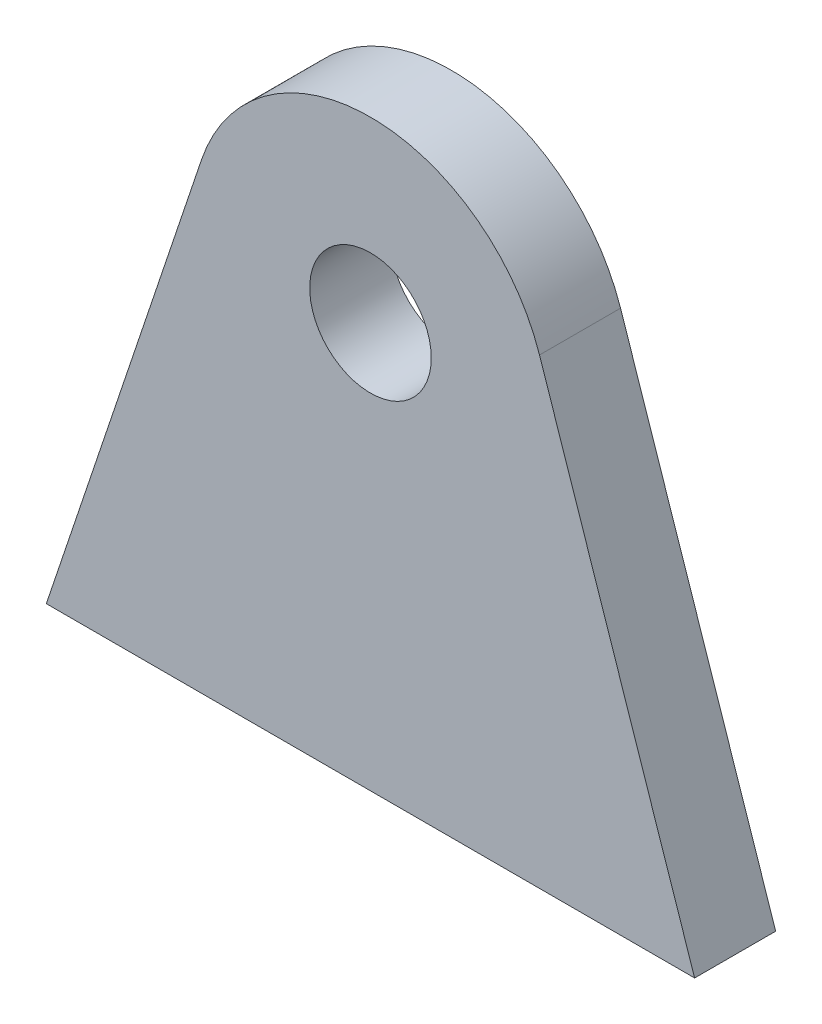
SolidWorks part; units mm, degrees
ref_plane "Front Plane" through (0, 0, 0) normal (0, 0, 1) x (1, 0, 0)
ref_plane "Top Plane" through (0, 0, 0) normal (0, 1, 0) x (1, 0, 0)
ref_plane "Right Plane" through (0, 0, 0) normal (1, 0, 0) x (0, 0, -1)
sketch "Sketch1" plane through (0, 0, 0) normal (0, 0, 1) x (1, 0, 0)
  line L0 (0, 0) -> (12.1569, 36.1977)
  line L1 (38.6431, 36.1977) -> (50.8, 0)
  line L2 (50.8, 0) -> (0, 0)
  arc A0 (12.1569, 36.1977) -> (38.6431, 36.1977) centre (25.4, 31.75) cw
  circle A1 centre (25.4, 31.75) radius 4.7625
  point P7 (25.4, 0)
  point P8 (25.4, 45.72)
  dimension "D3" = 9.525
  dimension "D4" = 13.97
  dimension "D1" = 50.8
  dimension "D2" = 31.75
extrude "Boss-Extrude1" add sketch "Sketch1" along normal blind 6.35
